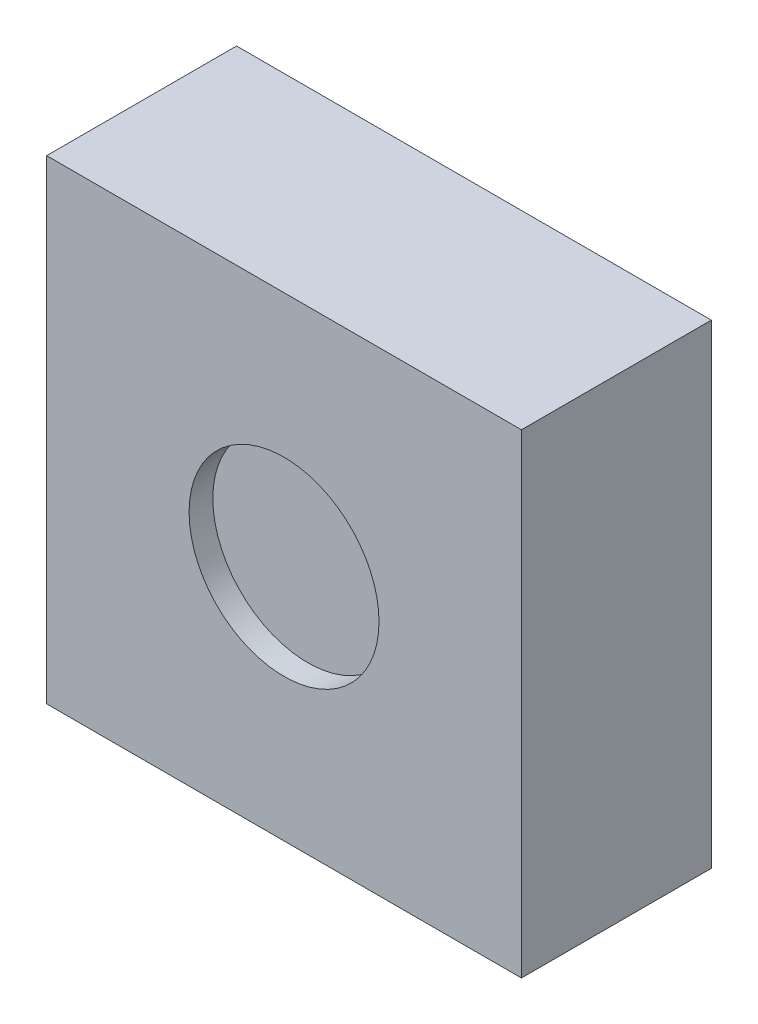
SolidWorks part; units mm, degrees
ref_plane "Front Plane" through (0, 0, 0) normal (0, 0, 1) x (1, 0, 0)
ref_plane "Top Plane" through (0, 0, 0) normal (0, 1, 0) x (1, 0, 0)
ref_plane "Right Plane" through (0, 0, 0) normal (1, 0, 0) x (0, 0, -1)
sketch "Sketch1" plane through (0, 0, 0) normal (0, 0, 1) x (1, 0, 0)
  line L0 (-63.5, 63.5) -> (63.5, 63.5)
  line L1 (63.5, 63.5) -> (63.5, -63.5)
  line L2 (0, 0) -> (0, 27.8442) construction
  line L3 (0, 0) -> (27.2017, 0) construction
  line L4 (-63.5, -63.5) -> (63.5, -63.5)
  line L5 (-63.5, 63.5) -> (-63.5, -63.5)
  point P8 (63.5, 0)
  point P10 (0, -63.5)
  point P11 (0, 63.5)
  dimension "D1" = 127
extrude "Extrude1" add sketch "Sketch1" along normal blind 50.8
sketch "Sketch2" plane through (0, 0, 50.8) normal (0, 0, 1) x (1, 0, 0)
  circle A0 centre (0, 0) radius 25.4
  dimension "D1" = 50.8
extrude "Cut-Extrude1" cut sketch "Sketch2" against normal blind 6.35
sketch "Sketch3" plane through (0, 0, 0) normal (0, 0, -1) x (-1, 0, 0)
  line L0 (0, 0) -> (0, 68.167) construction
  line L1 (0, 0) -> (63.5, 0) construction
  line L2 (63.5, 63.5) -> (63.5, -63.5) construction
  line L3 (0, 68.167) -> (0, 63.5) construction
  line L4 (-63.5, 63.5) -> (63.5, 63.5) construction
  circle A0 centre (-47.625, 47.625) radius 3.175
  circle A1 centre (47.625, 47.625) radius 3.175
  circle A2 centre (47.625, -47.625) radius 3.175
  circle A3 centre (-47.625, -47.625) radius 3.175
  dimension "D1" = 6.35
  dimension "D3" = 95.25
  dimension "D2" = 95.25
extrude "1/4\" Tap" cut sketch "Sketch3" against normal blind 12.7
